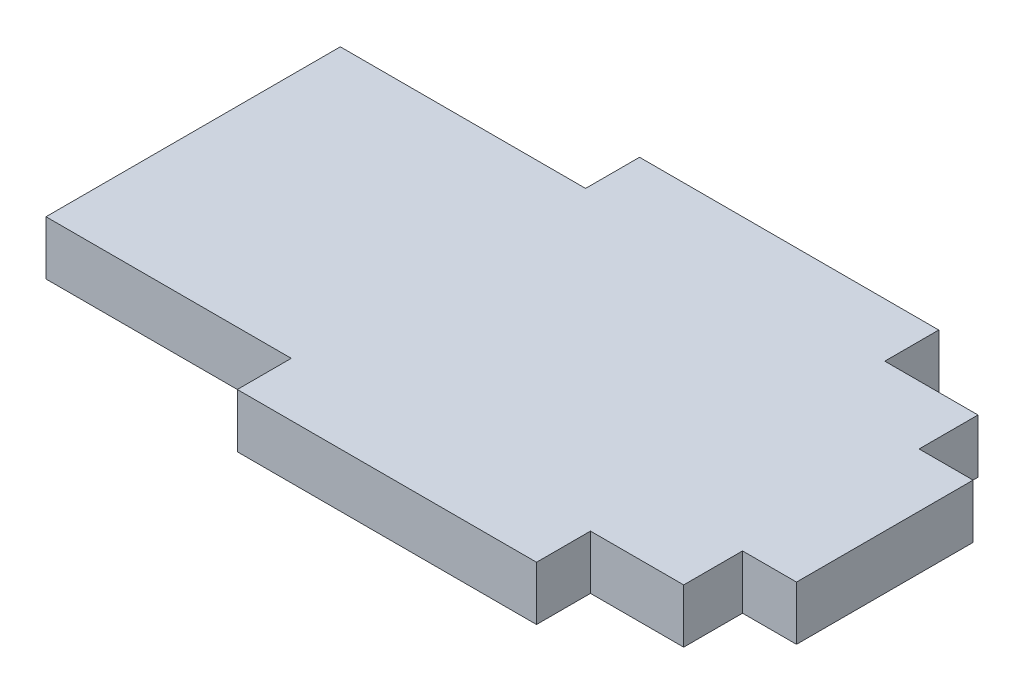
SolidWorks part; units mm, degrees
ref_plane "Alzado" through (0, 0, 0) normal (0, 0, 1) x (1, 0, 0)
ref_plane "Planta" through (0, 0, 0) normal (0, 1, 0) x (1, 0, 0)
ref_plane "Vista lateral" through (0, 0, 0) normal (1, 0, 0) x (0, 0, -1)
sketch "Croquis1" plane through (0, 0, 0) normal (0, 1, 0) x (1, 0, 0)
  line L0 (-7.5, 15) -> (-7.5, 20.5)
  line L1 (32.5, 15) -> (23, 15)
  line L2 (32.5, 15) -> (32.5, 9)
  line L3 (32.5, -15) -> (23, -15)
  line L4 (-32.5, 15) -> (-32.5, -15)
  line L5 (32.5, 15) -> (-32.5, -15) construction
  line L6 (32.5, -15) -> (-32.5, 15) construction
  line L7 (-7.5, 20.5) -> (23, 20.5)
  line L8 (23, 20.5) -> (23, 15)
  line L9 (-7.5, 15) -> (-32.5, 15)
  line L10 (-7.5, -15) -> (-7.5, -20.5)
  line L11 (-7.5, -20.5) -> (23, -20.5)
  line L12 (23, -20.5) -> (23, -15)
  line L13 (-7.5, -15) -> (-32.5, -15)
  line L14 (32.5, 9) -> (38, 9)
  line L15 (38, 9) -> (38, -9)
  line L16 (38, -9) -> (32.5, -9)
  line L17 (32.5, -9) -> (32.5, -15)
  point P0 (0, 0)
  dimension "D1" = 30.5
  dimension "D2" = 65
  dimension "D3" = 30
  dimension "D4" = 9.5
  dimension "D5" = 6
  dimension "D6" = 6
extrude "Saliente-Extruir1" add sketch "Croquis1" along normal blind 5.5
